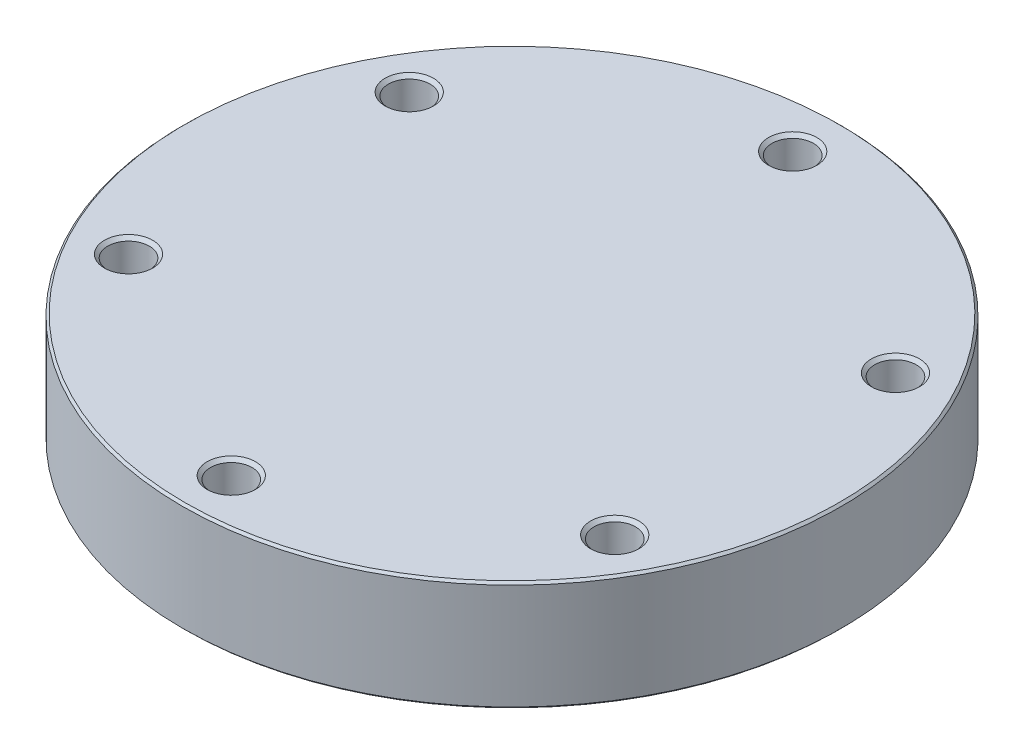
SolidWorks part; units mm, degrees
ref_plane "Front" through (0, 0, 0) normal (0, 0, 1) x (1, 0, 0)
ref_plane "Top" through (0, 0, 0) normal (0, 1, 0) x (1, 0, 0)
ref_plane "Right" through (0, 0, 0) normal (1, 0, 0) x (0, 0, -1)
sketch "Sketch1" plane through (0, 0, 0) normal (0, 1, 0) x (1, 0, 0)
  circle A0 centre (0, 0) radius 37.2745
  dimension "D1" = 74.549
extrude "Boss-Extrude1" add sketch "Sketch1" along normal blind 12.446
hole_wizard "#13 (0.185) Diameter Hole1" positions "Sketch2" profile "Sketch3" hole size "#13" standard "ANSI Inch"
sketch "Sketch2" plane through (0, 12.446, 0) normal (0, 1, 0) x (1, 0, 0)
  point P0 (0, 31.75)
  point P10 (27.4963, 15.875)
  point P11 (27.4963, -15.875)
  point P12 (0, -31.75)
  point P13 (-27.4963, -15.875)
  point P14 (-27.4963, 15.875)
  dimension "D1" = 31.75
  dimension "D2" = 6
sketch "Sketch3" plane through (0, 12.446, -31.75) normal (1, 0, 0) x (0, 0, 1)
  line L0 (0, 0) -> (0, 12.446)
  line L1 (0, 12.446) -> (2.7305, 12.446)
  line L2 (2.3495, 12.065) -> (2.3495, 0.381)
  line L3 (2.3495, 0.381) -> (2.7305, 0)
  line L5 (2.7305, 0) -> (0, 0)
  line L6 (-2.3495, 0.381) -> (-2.7305, 0) construction
  line L7 (2.7305, 12.446) -> (2.3495, 12.065)
  line L8 (-2.7305, 12.446) -> (-2.3495, 12.065) construction
  line L11 (0, -6.35) -> (0, 107.95) construction
  dimension "Thru Hole Dia." = 4.699
  dimension "Thru Hole Depth" = 12.446
  dimension "Near C'Sink Dia." = 5.461
  dimension "Near C'Sink Angle" = 90
  dimension "Far C'Sink Dia." = 5.461
  dimension "Far C'Sink Angle" = 90
chamfer "Chamfer1" distance 0.254 angle 45 2 edges at (0, 0, 37.2745) (0, 12.446, 37.2745)
sketch "Sketch4" plane through (0, 0, 0) normal (0, -1, 0) x (1, 0, 0)
  circle A0 centre (0, 0) radius 27.6987
  circle A1 centre (0, 0) radius 23.6093
  dimension "D1" = 4.0894
  dimension "D2" = 47.2186
extrude "Cut-Extrude1" cut sketch "Sketch4" against normal blind 2.6416
fillet "Fillet1" radius 0.381 2 edges at (0, 2.6416, -23.6093) (0, 2.6416, -27.6987)
chamfer "Chamfer2" distance 0.127 angle 45 2 edges at (0, 0, -27.6987) (0, 0, -23.6093)
